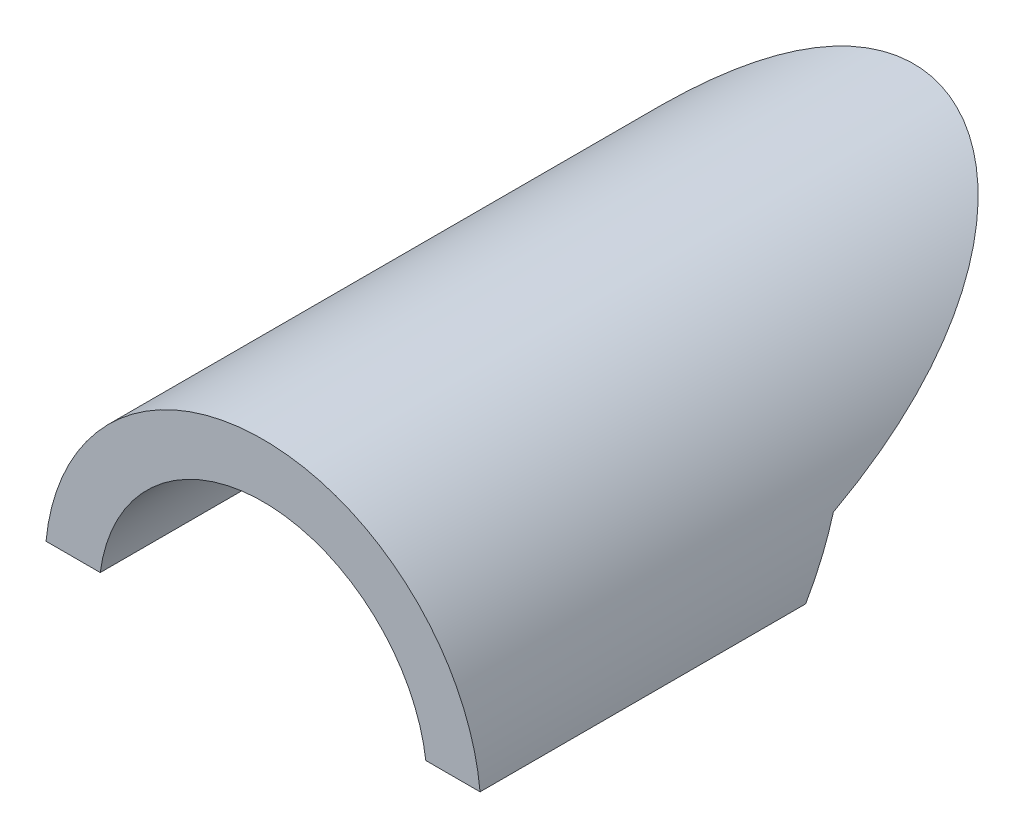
SolidWorks part; units mm, degrees
ref_plane "Front Plane" through (0, 0, 0) normal (0, 0, 1) x (1, 0, 0)
ref_plane "Top Plane" through (0, 0, 0) normal (0, 1, 0) x (1, 0, 0)
ref_plane "Right Plane" through (0, 0, 0) normal (1, 0, 0) x (0, 0, -1)
sketch "Sketch2" plane through (0, 0, 0) normal (0, 0, 1) x (1, 0, 0)
  line L0 (0, 0) -> (25.4, 0)
  line L1 (177.8, 0) -> (203.2, 0)
  arc A0 (25.4, 0) -> (177.8, 0) centre (101.6, -9.9874) cw
  arc A1 (0, 0) -> (203.2, 0) centre (101.6, -9.9874) cw
  dimension "D4" = 0
  dimension "D1" = 25.4
  dimension "D2" = 25.4
  dimension "D3" = 203.2
extrude "Boss-Extrude2" add sketch "Sketch2" along normal blind 304.8
sketch "Sketch3" plane through (0, 0, 0) normal (0, 0, -1) x (-1, 0, 0)
  line L0 (-203.2, 0) -> (-189.3548, 0)
  line L1 (-203.2, 0) -> (-203.2, 11.9087)
  line L2 (-189.3548, 0) -> (-189.3548, 11.9087)
  line L3 (-203.2, 11.9087) -> (-189.3548, 11.9087)
  line L4 (-177.8, 0) -> (-203.2, 0) construction
extrude "Boss-Extrude3" add sketch "Sketch3" along normal blind 6.35
sketch "Sketch4" plane through (203.2, 0, 0) normal (1, 0, 0) x (0, 0, -1)
  line L0 (-304.8, 0) -> (0, 0) construction
  line L1 (0, 0) -> (0, 92.1023) construction
  line L2 (-152.4, 0) -> (24.8453, -50.6472)
  line L3 (24.8453, -50.6472) -> (27.767, 49.959)
  line L4 (27.767, 49.959) -> (0, 92.2635)
  line L5 (-152.4, 0) -> (-133.7202, 25.0258)
  arc A1 (-133.7202, 25.0258) -> (0, 92.2635) centre (-313.423, 549.0012) ccw
extrude "Cut-Extrude1" cut sketch "Sketch4" against normal blind 228.6
